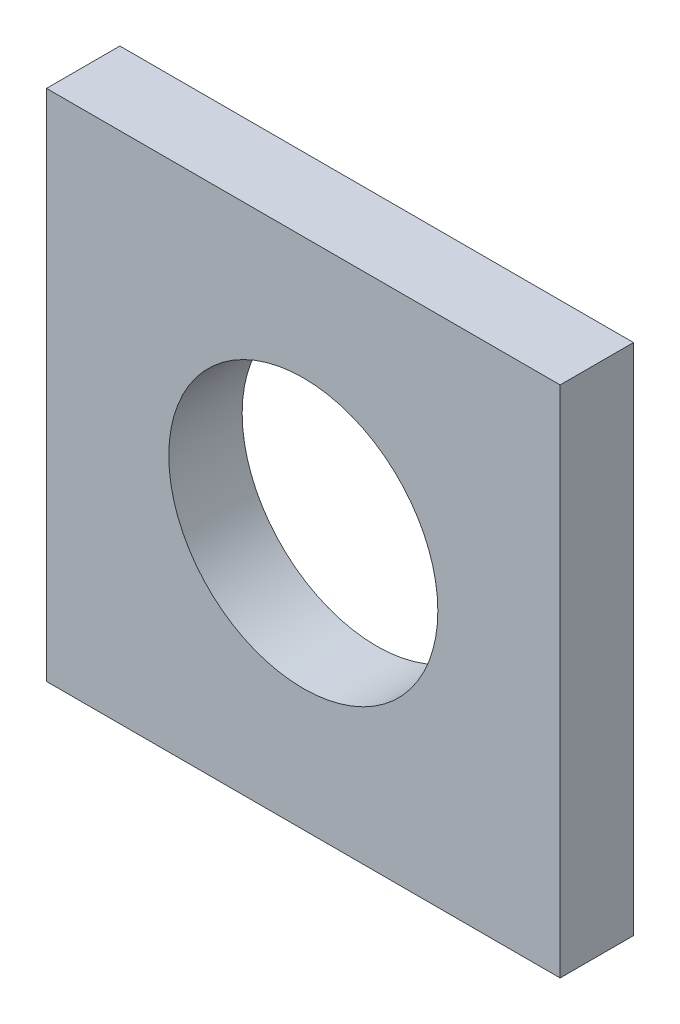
SolidWorks part; units mm, degrees
ref_plane "Front Plane" through (0, 0, 0) normal (0, 0, 1) x (1, 0, 0)
ref_plane "Top Plane" through (0, 0, 0) normal (0, 1, 0) x (1, 0, 0)
ref_plane "Right Plane" through (0, 0, 0) normal (1, 0, 0) x (0, 0, -1)
sketch "Sketch1" plane through (0, 0, 0) normal (0, 0, 1) x (1, 0, 0)
  line L1 (-53.5952, 36.2315) -> (-11.5952, 36.2315)
  line L2 (-53.5952, 36.2315) -> (-53.5952, -5.7685)
  line L3 (-53.5952, -5.7685) -> (-11.5952, -5.7685)
  line L4 (-11.5952, 36.2315) -> (-11.5952, -5.7685)
  line L5 (-53.5952, 36.2315) -> (-11.5952, -5.7685) construction
  line L6 (-53.5952, -5.7685) -> (-11.5952, 36.2315) construction
  circle A0 centre (-32.5952, 15.2315) radius 11
  dimension "D1" = 22
  dimension "D2" = 42
  dimension "D3" = 42
extrude "Boss-Extrude1" add sketch "Sketch1" along normal blind 6
